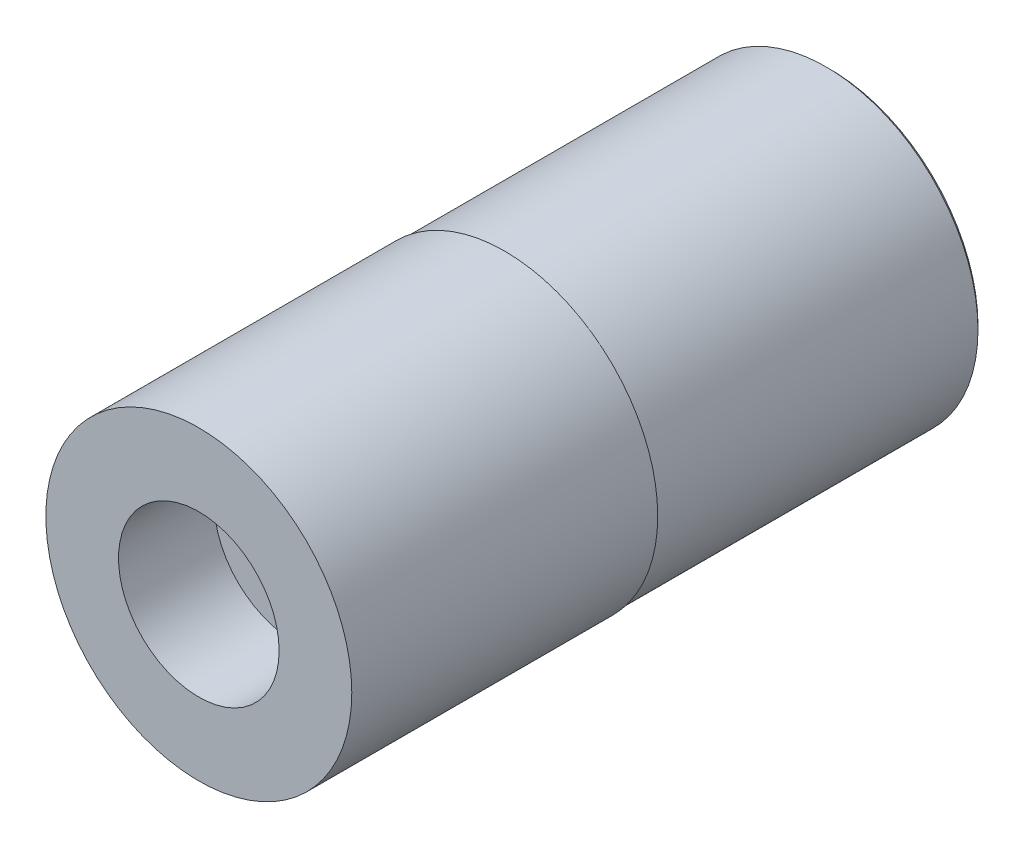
SolidWorks part; units mm, degrees
ref_plane "Front Plane" through (0, 0, 0) normal (0, 0, 1) x (1, 0, 0)
ref_plane "Top Plane" through (0, 0, 0) normal (0, 1, 0) x (1, 0, 0)
ref_plane "Right Plane" through (0, 0, 0) normal (1, 0, 0) x (0, 0, -1)
sketch "Sketch1" plane through (0, 0, 0) normal (1, 0, 0) x (0, 0, -1)
  line L2 (0, 8) -> (0, 4.2)
  line L3 (32.75, 8) -> (0, 8)
  line L4 (-3.7979, 0) -> (49996.2021, 0) construction
  line L8 (25, 1.75) -> (5, 1.75)
  line L9 (5, 4.2) -> (5, 1.75)
  line L10 (5, 4.2) -> (0, 4.2)
  line L12 (33, 4) -> (33, 7.75)
  line L16 (33, 7.75) -> (32.75, 8)
  line L17 (33, 4) -> (25, 4)
  line L18 (25, 1.75) -> (25, 4)
  dimension "D1" = 33
  dimension "D2" = 45
  dimension "D3" = 0.25
  dimension "D4" = 16
  dimension "D5" = 8.4
  dimension "D6" = 5
  dimension "D7" = 3.5
  dimension "D8" = 8
  dimension "D9" = 8
revolve "Revolve1" add sketch "Sketch1" angle 360 about L4
sketch "Sketch4" plane through (0, 0, 0) normal (1, 0, 0) x (0, 0, -1)
  line L0 (0, 0) -> (50000, 0) construction
  line L1 (33, -7.75) -> (33, 7.75) construction
  line L2 (16, 8.935) -> (33, 8.935)
  line L3 (16, 8.935) -> (16, 7.935)
  line L4 (16, 7.935) -> (33, 7.935)
  line L5 (33, 8.935) -> (33, 7.935)
  line L6 (32.75, 8) -> (0, 8) construction
  line L9 (0, 8.8) -> (0, -8.8) construction
  dimension "D1" = 1
  dimension "D2" = 0.065
  dimension "D3" = 16
revolve "Cut-Revolve1" cut sketch "Sketch4" angle 360 about L0
sketch "Sketch3" plane through (0, 0, -5) normal (0, 0, 1) x (1, 0, 0)
  line L0 (0, 0) -> (0, 50000) construction
  line L1 (1.0104, 1.75) -> (-1.0104, 1.75)
  line L2 (-1.0104, 1.75) -> (-2.0207, 0)
  line L3 (-2.0207, 0) -> (-1.0104, -1.75)
  line L4 (-1.0104, -1.75) -> (1.0104, -1.75)
  line L5 (1.0104, -1.75) -> (2.0207, 0)
  line L6 (2.0207, 0) -> (1.0104, 1.75)
  line L7 (0, 0) -> (50000, 0) construction
  circle A0 centre (0, 0) radius 1.75 construction
  circle A1 centre (0, 0) radius 1.75 construction
extrude "Cut-Extrude2" cut sketch "Sketch3" against normal blind 4
